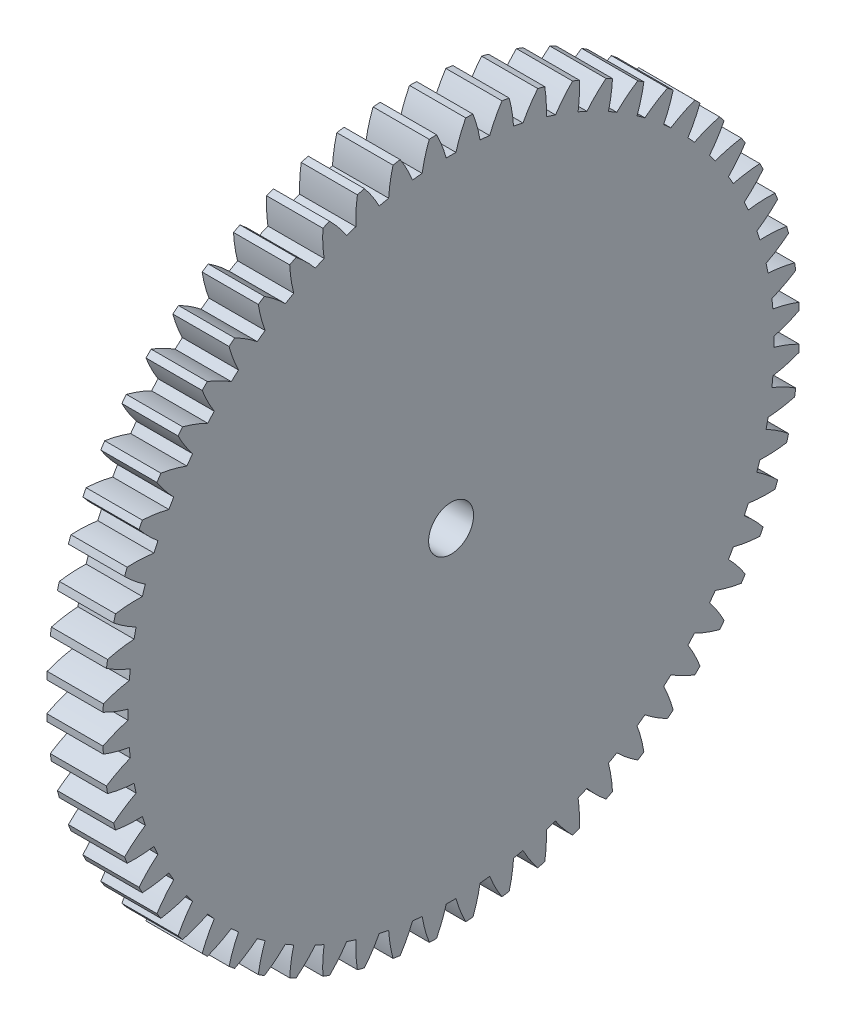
SolidWorks part; units mm, degrees
ref_plane "Front Plane" through (0, 0, 0) normal (0, 0, 1) x (1, 0, 0)
ref_plane "Top Plane" through (0, 0, 0) normal (0, 1, 0) x (1, 0, 0)
ref_plane "Right Plane" through (0, 0, 0) normal (1, 0, 0) x (0, 0, -1)
inserted part "spur gear_am<1>@tmpAssm"
sketch "Sketch1" plane through (-16.4786, 0, 0) normal (1, 0, 0) x (0, 0, -1)
  line L0 (-4.9911, 7.4255) -> (9.4662, 7.4255) construction
  line L1 (-4.9911, 7.4255) -> (-22.3833, 7.4255) construction
  circle A0 centre (-9.9911, 7.4255) radius 1
  circle A1 centre (0.0089, 7.4255) radius 1
  circle A2 centre (-4.9911, 7.4255) radius 2 construction
  dimension "D1" = 5
  dimension "D2" = 5
extrude "Cut-Extrude1" [suppressed] cut sketch "Sketch1" against normal blind 5
sketch "Sketch3" plane through (-16.4786, 0, 0) normal (1, 0, 0) x (0, 0, -1)
  line L1 (-3.2618, 4.6771) -> (-1.8249, 6.7049)
  line L2 (-1.8249, 6.7049) -> (-2.2427, 9.1548)
  line L3 (-2.2427, 9.1548) -> (-4.2705, 10.5917)
  line L4 (-4.2705, 10.5917) -> (-6.7204, 10.1739)
  line L5 (-6.7204, 10.1739) -> (-8.1573, 8.1461)
  line L6 (-8.1573, 8.1461) -> (-7.7395, 5.6962)
  line L7 (-7.7395, 5.6962) -> (-5.7117, 4.2593)
  line L8 (-5.7117, 4.2593) -> (-3.2618, 4.6771)
  circle A0 centre (-4.9911, 7.4255) radius 3 construction
extrude "Cut-Extrude2" [suppressed] cut sketch "Sketch3" against normal blind 5 contours L4 L5 L6 L7 L8 L1 L2 L3
